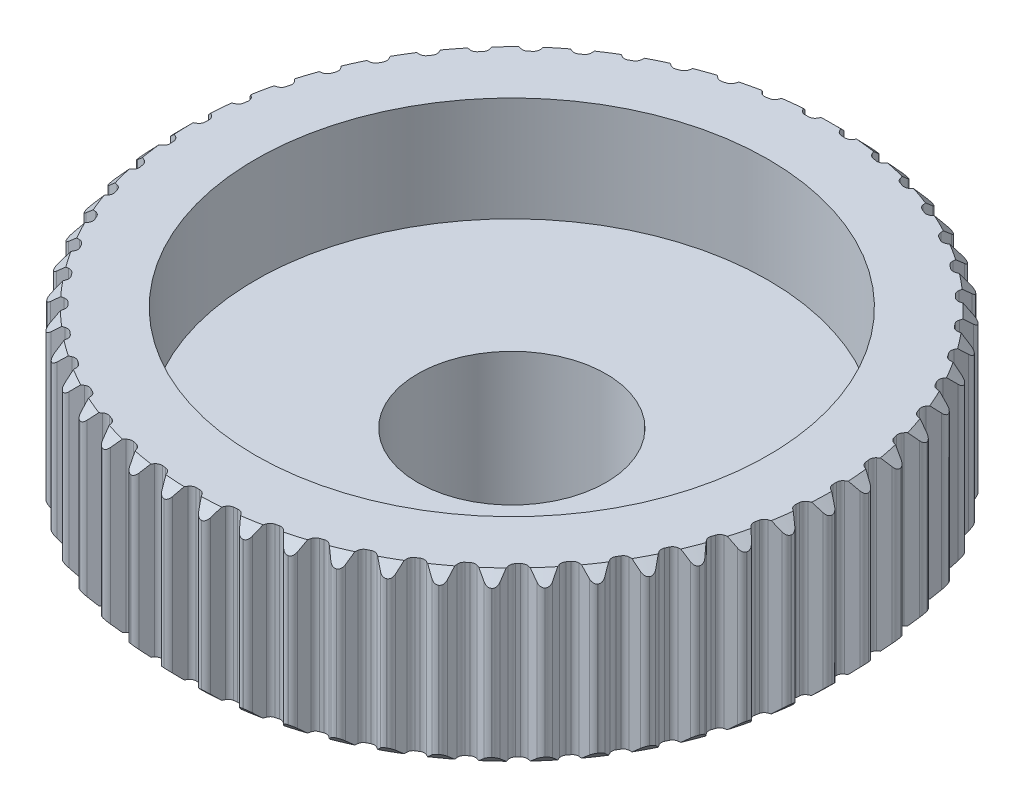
SolidWorks part; units mm, degrees
ref_plane "Front" through (0, 0, 0) normal (0, 0, 1) x (1, 0, 0)
ref_plane "Top" through (0, 0, 0) normal (0, 1, 0) x (1, 0, 0)
ref_plane "Right" through (0, 0, 0) normal (1, 0, 0) x (0, 0, -1)
sketch "Sketch1" plane through (0, 0, 0) normal (0, 1, 0) x (1, 0, 0)
  circle A0 centre (0, 0) radius 2.4765
  dimension "D1" = 4.953
extrude "Extrude1" add sketch "Sketch1" along normal blind 0.889
sketch "Sketch2" plane through (0, 0.889, 0) normal (0, 1, 0) x (-1, 0, 0)
  circle A0 centre (0, 0) radius 4.0005
  dimension "D1" = 8.001
extrude "Extrude2" add sketch "Sketch2" along normal blind 2.032
sketch "Sketch3" plane through (0, 2.921, 0) normal (0, 1, 0) x (-1, 0, 0)
  circle A0 centre (0, 0) radius 3.1115
  dimension "D1" = 6.223
extrude "Cut-Extrude1" cut sketch "Sketch3" against normal blind 1.27
sketch "Sketch4" plane through (0, 2.921, 0) normal (0, 1, 0) x (-1, 0, 0)
  line L0 (0.3175, 4.209) -> (-0.3175, 4.209)
  line L1 (0.3175, 4.209) -> (0.0635, 3.8095)
  line L2 (0.0635, 3.8095) -> (-0.0635, 3.8095)
  line L3 (-0.0635, 3.8095) -> (-0.3175, 4.209)
  circle A1 centre (0, 0) radius 4.0005 construction
  dimension "D2" = 0.0635
  dimension "D1" = 0.127
  dimension "D3" = 3.81
  dimension "D4" = 0.635
extrude "Cut-Extrude2" cut sketch "Sketch4" against normal blind 2.54
fillet "Fillet1" radius 0.0762 4 edges at (-0.1823, 1.905, 3.9963) (-0.0635, 1.905, 3.8095) (0.1823, 1.905, 3.9963) (0.0635, 1.905, 3.8095)
pattern_circular "CirPattern2" count 55 over 360 about axis through (0, 0, 0) along (0, 1, 0) of "Fillet1", "Cut-Extrude2"
sketch "Sketch5" plane through (0, 0, 0) normal (0, 0, 1) x (1, 0, 0)
  line L0 (-4.0005, 2.794) -> (-3.8735, 2.921)
  line L1 (-3.8735, 2.921) -> (-4.0005, 2.921)
  line L2 (-4.0005, 2.921) -> (-4.0005, 2.794)
  line L3 (-4.0005, 0.889) -> (-3.8735, 0.889)
  line L4 (-3.8735, 0.889) -> (-4.0005, 1.016)
  line L5 (-4.0005, 1.016) -> (-4.0005, 0.889)
  line L7 (0, 0.889) -> (0, 0) construction
  dimension "D1" = 45
  dimension "D2" = 45
  dimension "D3" = 0.127
  dimension "D4" = 4.0005
revolve "Cut-Revolve1" cut sketch "Sketch5" angle 360 about axis through (0, 0.889, 0) along (0, -1, 0)
sketch "Sketch6" plane through (0, 1.651, 0) normal (0, 1, 0) x (-1, 0, 0)
  circle A0 centre (0, 0) radius 1.143
  dimension "D1" = 2.286
extrude "Cut-Extrude3" cut sketch "Sketch6" against normal through all
